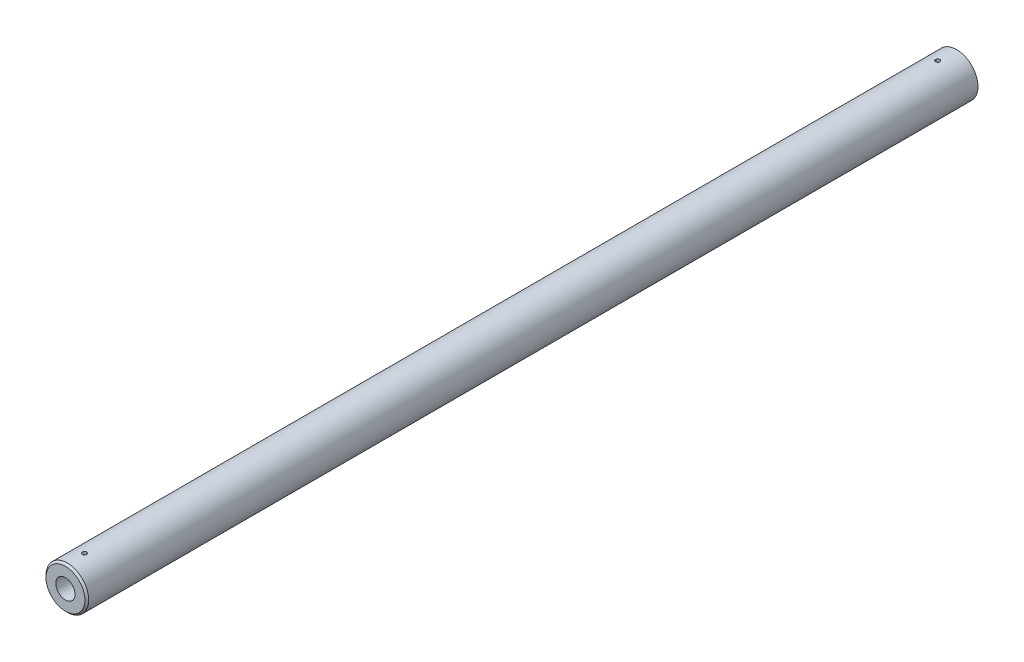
SolidWorks part; units mm, degrees
ref_plane "Plan de face" through (0, 0, 0) normal (0, 0, 1) x (1, 0, 0)
ref_plane "Plan de dessus" through (0, 0, 0) normal (0, 1, 0) x (1, 0, 0)
ref_plane "Plan de droite" through (0, 0, 0) normal (1, 0, 0) x (0, 0, -1)
sketch "Esquisse2" plane through (0, 0, 0) normal (1, 0, 0) x (0, 0, -1)
  line L0 (0, 20.5) -> (0, 10.16)
  line L1 (938, 22.5) -> (938, 10.16)
  line L3 (100, 10.5) -> (100, 10.16)
  line L4 (838.2887, 10.5) -> (838, 10)
  line L5 (838.2887, 10.5) -> (848.2887, 10.5)
  line L6 (100, 10.16) -> (0, 10.16)
  line L7 (848.2887, 10.16) -> (938, 10.16)
  line L8 (110, 10.5) -> (100, 10.5)
  line L9 (848.2887, 10.5) -> (848.2887, 10.16)
  line L12 (110, 10.5) -> (110.2887, 10)
  line L15 (0, 20.5) -> (2, 22.5)
  line L17 (938, 22.5) -> (2, 22.5)
  line L18 (838, 10) -> (110.2887, 10)
  line L60 (0, 0) -> (322.5481, 0) construction
  point P7 (474.1443, 10)
  point P9 (187.5, 22.5)
  dimension "D1" = 938
  dimension "D2" = 60
  dimension "D3" = 10.2887
  dimension "D4" = 0.34
  dimension "D5" = 100
revolve "Révolution1" add sketch "Esquisse2" angle 360 about L60
sketch "Esquisse3" plane through (0, 0, 0) normal (0, 1, 0) x (1, 0, 0)
  line L0 (0, 382.3117) -> (0, -14.1301) construction
  line L2 (-20.5, 0) -> (20.5, 0) construction
  line L3 (10.16, 938) -> (-10.16, 938) construction
  circle A0 centre (0, 918) radius 2.25
  circle A1 centre (0, 20) radius 2.25
  dimension "D1" = 4.5
  dimension "D2" = 4.5
  dimension "D3" = 20
  dimension "D4" = 20
extrude "Extrusion1" cut sketch "Esquisse3" against normal mid plane 60
